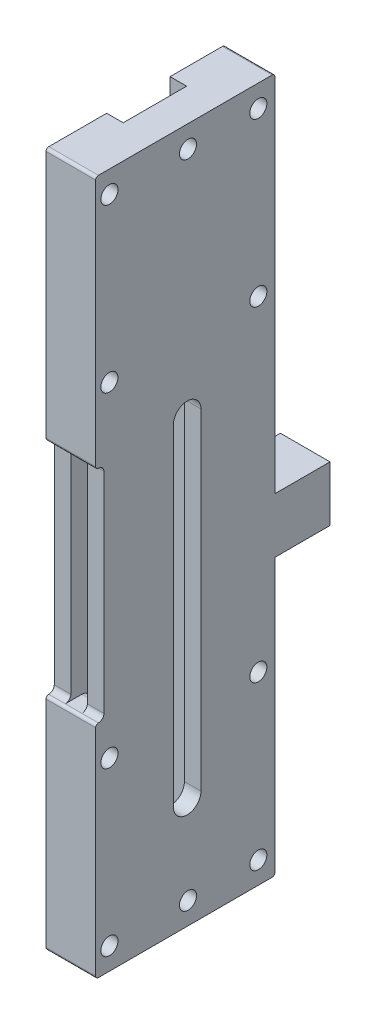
SolidWorks part; units mm, degrees
ref_plane "Front Plane" through (0, 0, 0) normal (0, 0, 1) x (1, 0, 0)
ref_plane "Top Plane" through (0, 0, 0) normal (0, 1, 0) x (1, 0, 0)
ref_plane "Right Plane" through (0, 0, 0) normal (1, 0, 0) x (0, 0, -1)
sketch "Sketch1" plane through (0, 0, 0) normal (0, 1, 0) x (1, 0, 0)
  line L0 (0, 0) -> (-3, 0)
  line L1 (-3, 0) -> (-3, 10)
  line L2 (-3, 10) -> (6, 10)
  line L3 (6, 10) -> (6, 4)
  line L4 (6, 4) -> (0, 4)
  line L5 (0, 4) -> (0, 0)
  dimension "D1" = 3
  dimension "D2" = 10
  dimension "D3" = 9
  dimension "D4" = 6
extrude "Boss-Extrude1" add sketch "Sketch1" along normal blind 126
sketch "Sketch2" plane through (0, 0, -4) normal (0, 0, 1) x (1, 0, 0)
  line L0 (0, 0) -> (6, 0) construction
  line L1 (6, 126) -> (3, 126)
  line L2 (6, 126) -> (6, 0)
  line L3 (6, 0) -> (3, 0)
  line L4 (3, 126) -> (3, 0)
extrude "Boss-Extrude2" add sketch "Sketch2" along normal blind 26.5
sketch "Sketch3" plane through (0, 0, 0) normal (0, -1, 0) x (1, 0, 0)
  line L0 (3, 22.5) -> (-3, 22.5)
  line L1 (-3, 22.5) -> (-3, 11.5)
  line L2 (-3, 11.5) -> (0, 11.5)
  line L3 (0, 11.5) -> (0, 17.5)
  line L4 (0, 17.5) -> (3, 17.5)
  line L5 (3, 22.5) -> (3, -4) construction
  line L6 (3, 17.5) -> (3, 22.5)
  line L7 (3, 22.5) -> (6, 22.5) construction
  line L8 (-3, -10) -> (-3, 0) construction
  dimension "D1" = 3
  dimension "D2" = 5
  dimension "D3" = 11
extrude "Boss-Extrude3" add sketch "Sketch3" against normal through all
sketch "Sketch4" plane through (0, 0, 22.5) normal (0, 0, 1) x (1, 0, 0)
  line L1 (0, 80) -> (3, 80)
  line L2 (0, 80) -> (0, 40)
  line L3 (0, 40) -> (3, 40)
  line L4 (3, 80) -> (3, 40)
  line L6 (-3, 126) -> (-3, 0) construction
  line L7 (-9.7404, 60) -> (19.6385, 60) construction
  line L12 (-3, 0) -> (6, 0) construction
  dimension "D1" = 3
  dimension "D2" = 40
  dimension "D3" = 3
  dimension "D4" = 60
extrude "Cut-Extrude1" cut sketch "Sketch4" against normal up to next
sketch "Sketch5" plane through (6, 0, 0) normal (1, 0, 0) x (0, 0, -1)
  line L0 (-5.9, 80) -> (-5.9, 20) construction
  line L1 (-3.4, 80) -> (-3.4, 20)
  line L2 (-8.4, 80) -> (-8.4, 20)
  line L3 (-22.5, 0) -> (-22.5, 126) construction
  line L4 (-22.5, 0) -> (10, 0) construction
  arc A0 (-3.4, 80) -> (-8.4, 80) centre (-5.9, 80) ccw
  arc A1 (-8.4, 20) -> (-3.4, 20) centre (-5.9, 20) ccw
  point P2 (-5.9, 50)
  dimension "D1" = 2.5
  dimension "D2" = 60
  dimension "D3" = 16.6
  dimension "D4" = 50
extrude "Cut-Extrude2" cut sketch "Sketch5" against normal up to next
sketch "Sketch6" plane through (0, 0, 0) normal (0, -1, 0) x (1, 0, 0)
  line L1 (0, -4) -> (3, -4)
  line L2 (0, -4) -> (0, 17.5)
  line L3 (0, 17.5) -> (3, 17.5)
  line L4 (3, -4) -> (3, 17.5)
extrude "Boss-Extrude4" add sketch "Sketch6" against normal blind 8 contours L2 L3 L4 L1
sketch "Sketch7" plane through (0, 126, 0) normal (0, 1, 0) x (1, 0, 0)
  line L0 (0, 4) -> (3, 4) construction
  line L1 (3, 4) -> (0, 4)
  line L2 (3, 4) -> (3, -17.5)
  line L3 (3, -17.5) -> (0, -17.5)
  line L4 (0, 4) -> (0, -17.5)
  line L5 (3, -17.5) -> (3, 4) construction
extrude "Boss-Extrude5" add sketch "Sketch7" against normal blind 8
sketch "Sketch8" plane through (-3, 0, 0) normal (-1, 0, 0) x (0, 0, 1)
  line L0 (5.75, 126.9868) -> (5.75, 114.1132) construction
  line L1 (0.5627, 122) -> (9.6868, 122) construction
  line L2 (0, 126) -> (11.5, 126) construction
  line L3 (17.5, 118) -> (-4, 118) construction
  line L6 (0, 126) -> (0, 0) construction
  line L7 (11.5, 126) -> (11.5, 0) construction
  line L8 (-59.5155, 63) -> (104.5728, 63) construction
  line L9 (0, 0) -> (11.5, 0) construction
  line L10 (-10, 126) -> (-10, 0) construction
  line L11 (0.5627, 4) -> (9.6868, 4) construction
  line L12 (5.75, -0.9868) -> (5.75, 11.8868) construction
  line L13 (-25.2154, 92.5) -> (4.4922, 92.5) construction
  line L14 (-15.0591, 122) -> (-3.6438, 122) construction
  line L15 (22.5, 126) -> (22.5, 0) construction
  circle A0 centre (5.75, 122) radius 1.55
  circle A1 centre (-7, 122) radius 1.55
  circle A3 centre (20, 4) radius 1.55
  circle A4 centre (-7, 4) radius 1.55
  circle A5 centre (5.75, 4) radius 1.55
  circle A6 centre (-7, 92.5) radius 1.55
  circle A8 centre (-7, 33.5) radius 1.55
  circle A9 centre (20, 33.5) radius 1.55
  circle A10 centre (20, 122) radius 1.55
  circle A11 centre (20, 92.5) radius 1.55
  dimension "D1" = 3.1
  dimension "D2" = 3
  dimension "D3" = 29.5
  dimension "D4" = 2.5
extrude "Cut-Extrude3" cut sketch "Sketch8" against normal up to next
sketch "Sketch9" plane through (6, 0, 0) normal (1, 0, 0) x (0, 0, -1)
  line L0 (10, 126) -> (10, 0) construction
  line L1 (10, 60) -> (20, 60)
  line L2 (10, 60) -> (10, 50)
  line L3 (10, 50) -> (20, 50)
  line L4 (20, 60) -> (20, 50)
  line L10 (-22.5, 0) -> (10, 0) construction
  dimension "D1" = 50
  dimension "D2" = 10
  dimension "D3" = 10
extrude "Boss-Extrude6" add sketch "Sketch9" against normal through all
sketch "Sketch10" plane through (6, 0, 0) normal (1, 0, 0) x (0, 0, -1)
  line L0 (-22.5, 0) -> (-22.5, 126) construction
  line L1 (-22.5, 80) -> (-22, 80)
  line L2 (-22.5, 80) -> (-22.5, 40)
  line L3 (-22.5, 40) -> (-22, 40)
  line L4 (-21, 79) -> (-21, 41)
  line L6 (-22.5, 40) -> (-22.5, 80) construction
  arc A0 (-22, 40) -> (-21, 41) centre (-22, 41) ccw
  arc A1 (-22, 80) -> (-21, 79) centre (-22, 79) cw
  point P13 (-21, 40)
  point P16 (-21, 80)
  dimension "D3" = 1
  dimension "D1" = 1.5
  dimension "D2" = 40
extrude "Cut-Extrude4" cut sketch "Sketch10" against normal through all
fillet "Fillet2" radius 0.5 6 edges at (1.5, 40, 22.5) (1.5, 80, 22.5) (1.5, 126, -10) (1.5, 126, 22.5) (1.5, 0, -10) (1.5, 0, 22.5)
fillet "Fillet3" radius 1.5 2 edges at (1.5, 40, 17.5) (1.5, 80, 17.5)
sketch "Sketch11" plane through (0, 126, 0) normal (0, 1, 0) x (1, 0, 0)
  line L0 (-3, -22) -> (-3, -11.5) construction
  line L1 (-3, -24.1178) -> (0, -24.1178)
  line L2 (-3, -24.1178) -> (-3, 42.4921)
  line L3 (-3, 42.4921) -> (0, 42.4921)
  line L4 (0, -24.1178) -> (0, 42.4921)
  dimension "D1" = 3
extrude "Cut-Extrude5" [suppressed] cut sketch "Sketch11" against normal through all contours L4 L3 L2 L1
